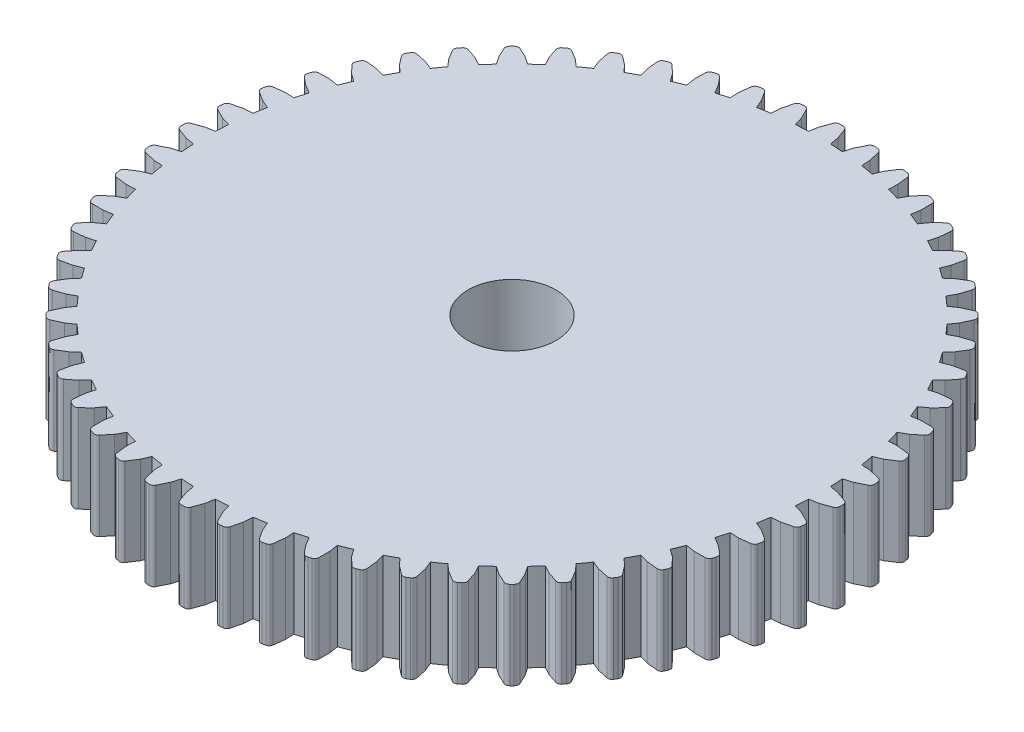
SolidWorks part; units mm, degrees
ref_plane "Front Plane" through (0, 0, 0) normal (0, 0, 1) x (1, 0, 0)
ref_plane "Top Plane" through (0, 0, 0) normal (0, 1, 0) x (1, 0, 0)
ref_plane "Right Plane" through (0, 0, 0) normal (1, 0, 0) x (0, 0, -1)
sketch "Sketch1" plane through (0, 0, 0) normal (0, 1, 0) x (1, 0, 0)
  circle A0 centre (0, 0) radius 88.9
  circle A1 centre (0, 0) radius 12.7
  dimension "D1" = 25.4
  dimension "D2" = 177.8
extrude "Boss-Extrude1" add sketch "Sketch1" along normal blind 25.4
sketch "Sketch2" plane through (0, 25.4, 0) normal (0, 1, 0) x (1, 0, 0)
  line L0 (-3.175, 88.8433) -> (3.175, 88.8433)
  line L1 (3.175, 88.8433) -> (2.7271, 91.3833)
  line L2 (2.7271, 91.3833) -> (1.3404, 95.1933)
  line L3 (1.3404, 95.1933) -> (-1.3404, 95.1933)
  line L4 (-1.3404, 95.1933) -> (-2.7271, 91.3833)
  line L5 (-2.7271, 91.3833) -> (-3.175, 88.8433)
  circle A0 centre (0, 0) radius 88.9 construction
  dimension "D1" = 80
  dimension "D2" = 110
  dimension "D3" = 6.35
  dimension "D4" = 2.54
  dimension "D5" = 3.81
extrude "Boss-Extrude2" add sketch "Sketch2" against normal blind 25.4
fillet "Fillet1" radius 1.27 2 edges at (1.3404, 12.7, -95.1933) (-1.3404, 12.7, -95.1933)
pattern_circular "CirPattern1" count 56 over 360 about axis through (0, 0, 0) along (0, 1, 0) of "Fillet1", "Boss-Extrude2"
sketch "Sketch3" plane through (0, 25.4, 0) normal (0, 1, 0) x (1, 0, 0)
  circle A0 centre (0, 0) radius 25.4
  circle A1 centre (0, 0) radius 12.7
  circle A2 centre (0, 0) radius 12.7 construction
  dimension "D1" = 50.8
extrude "Boss-Extrude3" add sketch "Sketch3" along normal blind 25.4
sketch "Sketch4" plane through (0, 50.8, 0) normal (0, 1, 0) x (1, 0, 0)
  line L0 (-3.175, 25.2008) -> (3.175, 25.2008)
  line L1 (3.175, 25.2008) -> (2.5032, 29.0108)
  line L2 (2.5032, 29.0108) -> (1.8829, 30.7151)
  line L3 (0.6894, 31.5508) -> (-0.6894, 31.5508)
  line L4 (-1.8829, 30.7151) -> (-2.5032, 29.0108)
  line L5 (-2.5032, 29.0108) -> (-3.175, 25.2008)
  circle A0 centre (0, 0) radius 25.4 construction
  arc A1 (0.6894, 31.5508) -> (1.8829, 30.7151) centre (0.6894, 30.2808) cw
  arc A2 (-0.6894, 31.5508) -> (-1.8829, 30.7151) centre (-0.6894, 30.2808) ccw
  point P11 (1.5787, 31.5508)
  dimension "D6" = 1.27
  dimension "D1" = 80
  dimension "D2" = 110
  dimension "D3" = 3.81
  dimension "D4" = 2.54
  dimension "D5" = 6.35
extrude "Boss-Extrude4" add sketch "Sketch4" against normal blind 25.4
pattern_circular "CirPattern2" count 16 over 360 about axis through (0, 0, 0) along (0, 1, 0) of "Boss-Extrude4"
sketch "Sketch5" plane through (0, 25.4, 0) normal (0, 1, 0) x (1, 0, 0)
  circle A0 centre (-26.2885, 18.8861) radius 118.2033
extrude "Cut-Extrude1" cut sketch "Sketch5" along normal blind 27.94
